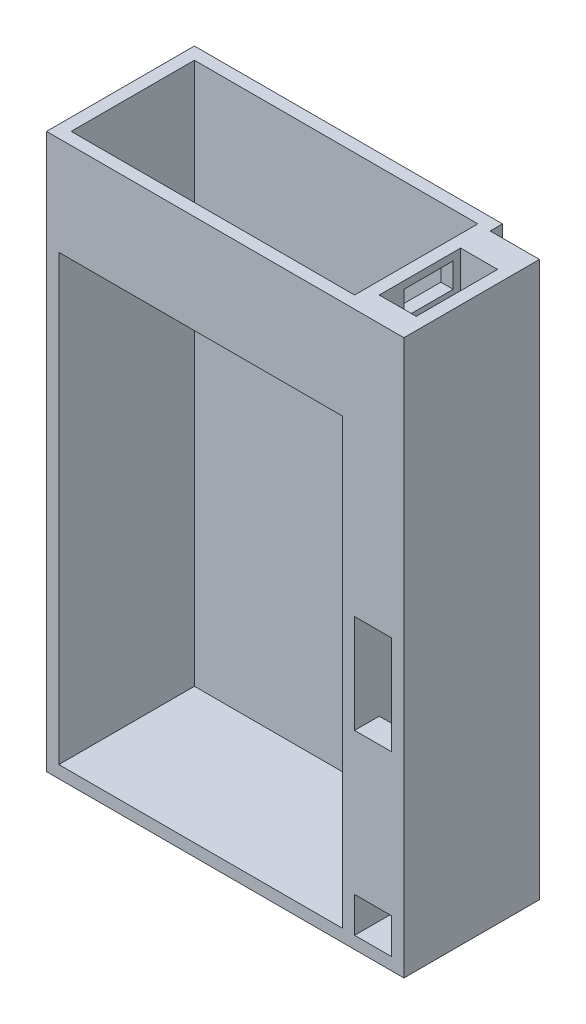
SolidWorks part; units mm, degrees
ref_plane "Alzado" through (0, 0, 0) normal (0, 0, 1) x (1, 0, 0)
ref_plane "Planta" through (0, 0, 0) normal (0, 1, 0) x (1, 0, 0)
ref_plane "Vista lateral" through (0, 0, 0) normal (1, 0, 0) x (0, 0, -1)
sketch "Sketch1" plane through (0, 0, 0) normal (0, 0, 1) x (1, 0, 0)
  line L0 (62.5, -112.5) -> (62.5, 112.5)
  line L1 (-57.5, -107.5) -> (57.5, -107.5)
  line L2 (-57.5, -107.5) -> (-57.5, 107.5)
  line L4 (57.5, -107.5) -> (57.5, 107.5)
  line L5 (-57.5, -107.5) -> (57.5, 107.5) construction
  line L6 (-57.5, 107.5) -> (57.5, -107.5) construction
  line L7 (-62.5, 112.5) -> (-57.5, 112.5)
  line L8 (-62.5, -112.5) -> (-62.5, 112.5)
  line L9 (-62.5, -112.5) -> (62.5, -112.5)
  line L10 (-57.5, 107.5) -> (-57.5, 112.5)
  line L11 (57.5, 107.5) -> (57.5, 112.5)
  line L12 (57.5, 112.5) -> (62.5, 112.5)
  line L14 (-62.5, 112.5) -> (62.5, 112.5) construction
  line L15 (-57.5, 107.5) -> (57.5, 107.5) construction
  point P0 (0, 0)
  dimension "D1" = 115
  dimension "D2" = 215
  dimension "D3" = 5
extrude "Boss-Extrude1" add sketch "Sketch1" along normal blind 55
sketch "Sketch2" plane through (0, 0, 0) normal (0, 0, 1) x (1, 0, 0)
  line L1 (-62.5, -112.5) -> (62.5, -112.5)
  line L2 (-62.5, -112.5) -> (-62.5, 112.5)
  line L3 (-62.5, 112.5) -> (62.5, 112.5)
  line L4 (62.5, -112.5) -> (62.5, 112.5)
  line L5 (-62.5, -112.5) -> (62.5, 112.5) construction
  line L6 (-62.5, 112.5) -> (62.5, -112.5) construction
  point P0 (0, 0)
extrude "Boss-Extrude2" add sketch "Sketch2" against normal blind 5
sketch "Sketch3" plane through (0, 0, 55) normal (0, 0, 1) x (1, 0, 0)
  line L0 (62.5, -112.5) -> (62.5, 112.5) construction
  line L1 (-62.5, 112.5) -> (62.5, 112.5)
  line L2 (-62.5, 112.5) -> (-62.5, 72.5)
  line L3 (-62.5, 72.5) -> (62.5, 72.5)
  line L4 (62.5, 112.5) -> (62.5, 72.5)
  dimension "D1" = 40
extrude "Boss-Extrude3" add sketch "Sketch3" against normal blind 5
sketch "Sketch6" plane through (62.5, 0, 0) normal (1, 0, 0) x (0, 0, -1)
  line L0 (-55, 112.5) -> (5, 112.5) construction
  line L1 (-35, 99.5) -> (-15, 99.5)
  line L2 (-35, 99.5) -> (-35, 109.5)
  line L4 (-15, 99.5) -> (-15, 109.5)
  line L5 (-15, 109.5) -> (-15, 112.5) construction
  line L8 (-35, 109.5) -> (-15, 109.5)
  point P0 (-25, 112.5)
  point P1 (-25, 109.5)
  dimension "D1" = 20
  dimension "D2" = 10
  dimension "D3" = 3
extrude "Cut-Extrude1" cut sketch "Sketch6" against normal blind 5
sketch "Sketch7" plane through (0, 0, 0) normal (0, 0, 1) x (1, 0, 0)
  line L0 (62.5, 112.5) -> (82.5, 112.5)
  line L1 (82.5, 112.5) -> (82.5, -112.5)
  line L2 (82.5, -112.5) -> (62.5, -112.5)
  line L3 (62.5, -112.5) -> (62.5, 112.5)
  dimension "D1" = 20
extrude "Boss-Extrude4" add sketch "Sketch7" along normal blind 12
sketch "Sketch8" plane through (0, 0, 12) normal (0, 0, 1) x (1, 0, 0)
  line L0 (62.5, -112.5) -> (82.5, -112.5)
  line L1 (82.5, -112.5) -> (82.5, 112.5)
  line L2 (62.5, -107.5) -> (77.5, -107.5)
  line L3 (77.5, -107.5) -> (77.5, 112.5)
  line L4 (62.5, -112.5) -> (62.5, -107.5)
  line L5 (77.5, 112.5) -> (82.5, 112.5)
  dimension "D1" = 5
extrude "Boss-Extrude5" add sketch "Sketch8" along normal blind 43
sketch "Sketch9" plane through (0, 0, 55) normal (0, 0, 1) x (1, 0, 0)
  line L0 (62.5, -93.1344) -> (77.5, -93.1344)
  line L1 (62.5, 112.5) -> (62.5, -107.5) construction
  line L2 (77.5, 112.5) -> (77.5, -107.5) construction
  line L3 (77.5, -93.1344) -> (77.5, -35.5)
  line L4 (77.5, 112.5) -> (77.5, -107.5) construction
  line L5 (62.5, 99.5) -> (62.5, 4.5)
  line L6 (62.5, -107.5) -> (62.5, 112.5) construction
  line L7 (62.5, 4.5) -> (77.5, 4.5)
  line L8 (77.5, 4.5) -> (77.5, 112.5)
  line L9 (77.5, 112.5) -> (62.5, 112.5)
  line L10 (62.5, 112.5) -> (62.5, 99.5)
  line L11 (77.5, -35.5) -> (62.5, -35.5)
  line L12 (62.5, -35.5) -> (62.5, -93.1344)
  dimension "D1" = 95
  dimension "D2" = 40
extrude "Boss-Extrude6" add sketch "Sketch9" against normal blind 10
